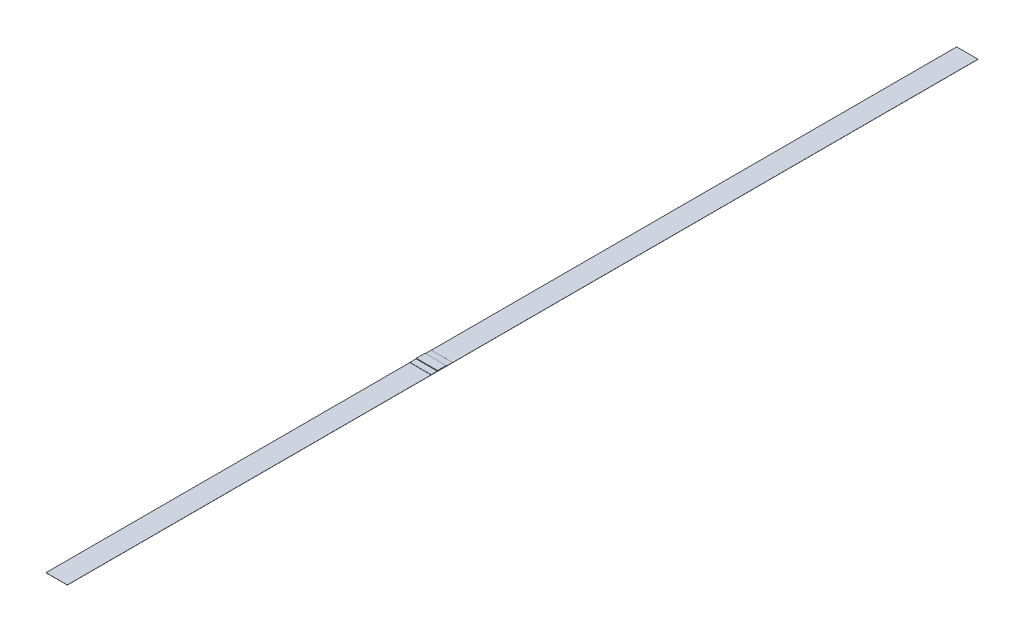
SolidWorks part; units mm, degrees
ref_plane "Front Plane" through (0, 0, 0) normal (0, 0, 1) x (1, 0, 0)
ref_plane "Top Plane" through (0, 0, 0) normal (0, 1, 0) x (1, 0, 0)
ref_plane "Right Plane" through (0, 0, 0) normal (1, 0, 0) x (0, 0, -1)
sketch "Sketch1" plane through (0, 0, 0) normal (0, 1, 0) x (1, 0, 0)
  line L5 (19.05, -76.2) -> (66.675, -76.2)
  line L6 (19.05, -76.2) -> (19.05, 1955.8)
  line L7 (19.05, 1955.8) -> (66.675, 1955.8)
  line L8 (66.675, -76.2) -> (66.675, 1955.8)
  dimension "D1" = 2032
extrude "Boss-Extrude1" add sketch "Sketch1" along normal blind 0.254
sketch "Sketch2" plane through (0, 0.254, 0) normal (0, 1, 0) x (1, 0, 0)
  line L1 (19.05, -76.2) -> (66.675, -76.2) construction
  line L5 (19.05, 735.7745) -> (66.675, 735.7745)
  line L6 (19.05, 735.7745) -> (19.05, 783.3995)
  line L7 (19.05, 783.3995) -> (66.675, 783.3995)
  line L8 (66.675, 735.7745) -> (66.675, 783.3995)
  dimension "D1" = 47.625
  dimension "D2" = 811.9745
extrude "Boss-Extrude2" add sketch "Sketch2" along normal blind 0.254 contours L5 L8 L7 L6
fillet "Fillet1" radius 0.127 8 edges at (42.8625, 0.508, -783.3995) (66.675, 0.381, -783.3995) (19.05, 0.381, -783.3995) (42.8625, 0.254, -735.7745) (19.05, 0.381, -735.7745) (66.675, 0.381, -735.7745) (42.8625, 0.508, -735.7745) (42.8625, 0.254, -783.3995)
sketch "Sketch3" plane through (0, 0.508, 0) normal (0, 1, 0) x (1, 0, 0)
  line L0 (19.05, 735.9015) -> (66.675, 735.9015) construction
  line L1 (19.05, 749.8715) -> (66.675, 749.8715)
  line L2 (19.05, 749.8715) -> (19.05, 769.3025)
  line L3 (19.05, 769.3025) -> (66.675, 769.3025)
  line L4 (66.675, 749.8715) -> (66.675, 769.3025)
  line L5 (66.675, 783.2725) -> (19.05, 783.2725) construction
  dimension "D1" = 13.97
  dimension "D2" = 13.97
extrude "Boss-Extrude3" add sketch "Sketch3" along normal blind 1.016
fillet "Fillet2" radius 0.127 4 edges at (42.8625, 0.508, -769.3025) (42.8625, 1.524, -769.3025) (42.8625, 1.524, -749.8715) (42.8625, 0.508, -749.8715)
